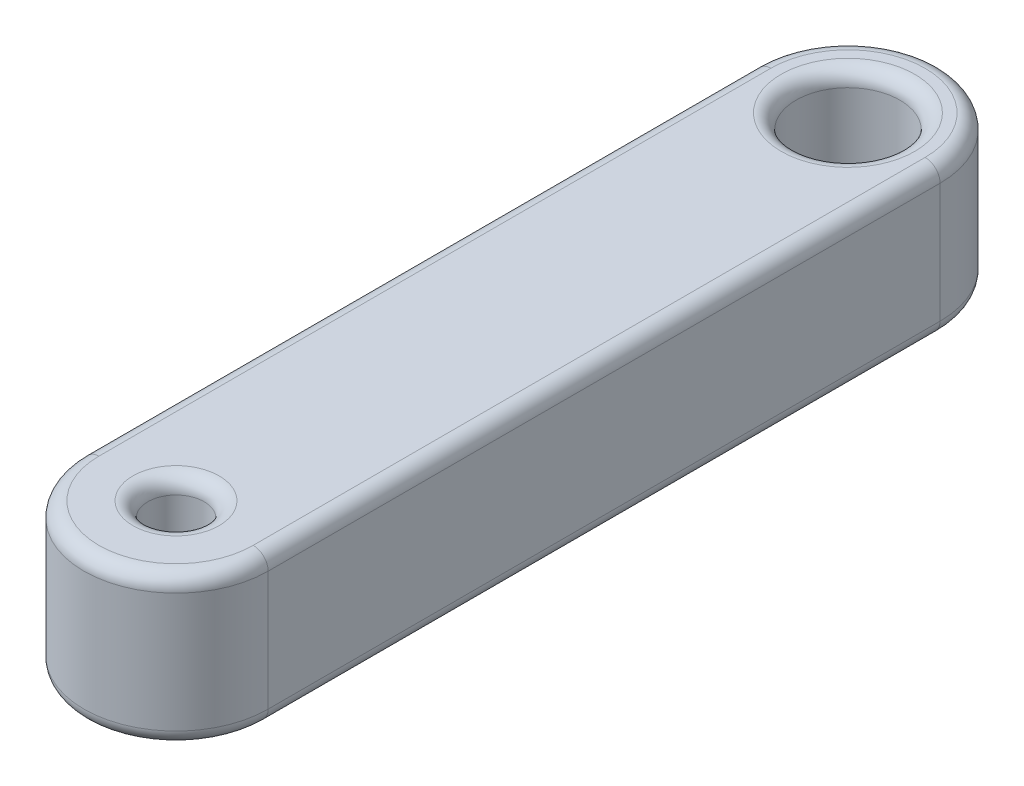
SolidWorks part; units mm, degrees
ref_plane "Front Plane" through (0, 0, 0) normal (0, 0, 1) x (1, 0, 0)
ref_plane "Top Plane" through (0, 0, 0) normal (0, 1, 0) x (1, 0, 0)
ref_plane "Right Plane" through (0, 0, 0) normal (1, 0, 0) x (0, 0, -1)
sketch "Sketch1" plane through (0, 0, 0) normal (0, 1, 0) x (1, 0, 0)
  line L0 (0, 0) -> (0, -45) construction
  line L1 (6.1688, 0) -> (6.1688, -45)
  line L2 (-6.1688, 0) -> (-6.1688, -45)
  arc A0 (6.1688, 0) -> (-6.1688, 0) centre (0, 0) ccw
  arc A1 (-6.1688, -45) -> (6.1688, -45) centre (0, -45) ccw
  circle A2 centre (0, 0) radius 3.475
  circle A3 centre (0, -45) radius 1.8875
  point P3 (0, -22.5)
extrude "Boss-Extrude1" add sketch "Sketch1" along normal blind 10
fillet "Fillet1" radius 1 12 edges at (0, 0, 46.8875) (0, 0, 3.475) (-6.1688, 0, 22.5) (0, 0, 51.1688) (6.1688, 0, 22.5) (0, 0, -6.1688) (0, 10, 46.8875) (6.1688, 10, 22.5) (0, 10, 51.1688) (-6.1688, 10, 22.5) (0, 10, -6.1688) (0, 10, 3.475)
equation "\"linkagehole.25\"= .25in + .6mm"
equation "\"D2@Sketch1\"=\"linkagehole.25\""
equation "\"linkagelength\"= 45"
equation "\"D1@Sketch1\"=\"linkagelength\""
equation "\"linkagehole.125\"= .125in + .6mm"
equation "\"D3@Sketch1\"=\"linkagehole.125\""
